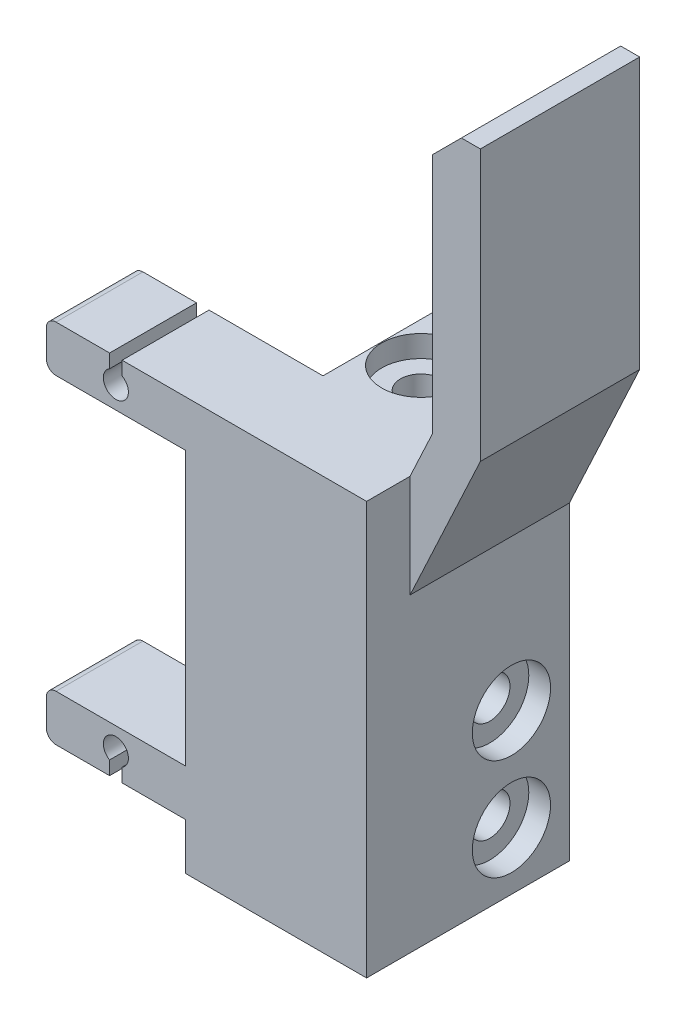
SolidWorks part; units mm, degrees
ref_plane "Front Plane" through (0, 0, 0) normal (0, 0, 1) x (1, 0, 0)
ref_plane "Top Plane" through (0, 0, 0) normal (0, 1, 0) x (1, 0, 0)
ref_plane "Right Plane" through (0, 0, 0) normal (1, 0, 0) x (0, 0, -1)
ref_plane "Plane1" through (0, 0, -10.16) normal (0, 0, -1) x (-1, 0, 0)
sketch "Sketch1" plane through (0, 0, -10.16) normal (0, 0, -1) x (-1, 0, 0)
  line L0 (20.137, 20.32) -> (-7.945, 20.32)
  line L1 (-7.945, 20.32) -> (-7.945, -15.875)
  line L2 (-7.945, -15.875) -> (20.137, -15.875)
  line L3 (20.137, -15.875) -> (20.137, 20.32)
  dimension "D1" = 20.137
  dimension "D2" = 7.945
  dimension "D3" = 20.32
  dimension "D4" = 15.875
extrude "Boss-Extrude1" add sketch "Sketch1" against normal blind 17.78
sketch "Sketch2" plane through (0, 0, -10.16) normal (0, 0, -1) x (-1, 0, 0)
  line L0 (-12.446, 48.26) -> (-14.1099, 48.26)
  line L1 (-14.1099, 48.26) -> (-14.1099, 24.5254)
  line L2 (-14.1099, 24.5254) -> (-7.945, 11.3048)
  line L3 (-7.945, 11.3048) -> (-7.945, 20.32)
  line L4 (-7.945, 20.32) -> (-9.906, 20.32)
  line L5 (-9.906, 20.32) -> (-9.906, 45.72)
  line L6 (-9.906, 45.72) -> (-12.446, 48.26)
  dimension "D1" = 7.945
  dimension "D2" = 9.906
  dimension "D3" = 12.446
  dimension "D4" = 14.1099
  dimension "D5" = 11.3048
  dimension "D6" = 20.32
  dimension "D7" = 24.5254
  dimension "D8" = 45.72
  dimension "D9" = 48.26
extrude "Boss-Extrude2" add sketch "Sketch2" against normal blind 13.97
sketch "Sketch3" plane through (0, 20.32, 0) normal (0, 1, 0) x (-1, 0, 0)
  line L0 (20.137, 0) -> (3.5, 0)
  line L1 (3.5, 0) -> (3.5, -10.16)
  line L2 (3.5, -10.16) -> (20.137, -10.16)
  line L3 (20.137, -10.16) -> (20.137, 0)
  line L4 (20.137, 7.62) -> (20.137, -10.16) construction
  line L5 (20.137, 7.62) -> (-7.945, 7.62) construction
  dimension "D1" = 16.637
  dimension "D2" = 7.62
  dimension "D3" = 17.78
extrude "Cut-Extrude1" cut sketch "Sketch3" against normal through all
sketch "Sketch4" plane through (0, 0, -10.16) normal (0, 0, -1) x (-1, 0, 0)
  line L0 (3.5, 15.875) -> (-3.5, 15.875)
  line L1 (-3.5, 15.875) -> (-3.5, -15.875)
  line L2 (-3.5, -15.875) -> (3.5, -15.875)
  line L3 (3.5, -15.875) -> (3.5, 15.875)
  line L4 (3.5, -15.875) -> (3.5, 20.32) construction
  line L5 (-12.446, 48.26) -> (-14.1099, 48.26) construction
  dimension "D1" = 7
  dimension "D2" = 32.385
  dimension "D3" = 64.135
extrude "Cut-Extrude2" cut sketch "Sketch4" against normal blind 10.16
sketch "Sketch5" plane through (0, 0, 7.62) normal (0, 0, 1) x (1, 0, 0)
  line L0 (-7.945, -15.875) -> (-7.945, -11.78)
  line L1 (-7.945, -11.78) -> (-20.137, -11.78)
  line L2 (-20.137, -11.78) -> (-20.137, -15.875)
  line L3 (-20.137, -15.875) -> (-7.945, -15.875)
  line L4 (-20.137, -15.875) -> (-20.137, 20.32) construction
  line L5 (7.945, -15.875) -> (-20.137, -15.875) construction
  dimension "D1" = 12.192
  dimension "D2" = 4.095
extrude "Cut-Extrude3" cut sketch "Sketch5" against normal through all
sketch "Sketch6" plane through (0, 0, 7.62) normal (0, 0, 1) x (1, 0, 0)
  line L0 (-13.491, -11.78) -> (-13.491, -10.5826)
  line L1 (-14.591, -10.5826) -> (-14.591, -11.78)
  line L2 (-14.591, -11.78) -> (-13.491, -11.78)
  line L3 (-7.945, -15.875) -> (-7.945, -11.78) construction
  line L4 (-7.945, -11.78) -> (-20.137, -11.78) construction
  arc A0 (-13.491, -10.5826) -> (-14.591, -10.5826) centre (-14.041, -9.63) cw
  dimension "D1" = 1.1
  dimension "D2" = 5.546
  dimension "D3" = 1.1974
extrude "Cut-Extrude4" cut sketch "Sketch6" against normal through all
sketch "Sketch7" plane through (0, 0, 7.62) normal (0, 0, 1) x (1, 0, 0)
  line L0 (-20.137, 16.256) -> (-20.137, -7.716)
  line L1 (-20.137, -7.716) -> (-7.945, -7.716)
  line L2 (-7.945, -7.716) -> (-7.945, 16.256)
  line L3 (-7.945, 16.256) -> (-20.137, 16.256)
  line L4 (-14.591, -10.5826) -> (-14.591, -11.78) construction
  line L5 (-7.945, -11.78) -> (-13.491, -11.78) construction
  dimension "D1" = 6.646
  dimension "D2" = 5.546
  dimension "D3" = 4.064
  dimension "D4" = 28.036
extrude "Cut-Extrude5" cut sketch "Sketch7" against normal through all
sketch "Sketch8" plane through (0, 0, 7.62) normal (0, 0, 1) x (1, 0, 0)
  line L0 (-14.591, 20.32) -> (-14.591, 19.1226)
  line L1 (-13.491, 19.1226) -> (-13.491, 20.32)
  line L2 (-13.491, 20.32) -> (-14.591, 20.32)
  line L3 (-20.137, -11.78) -> (-20.137, -7.716) construction
  line L4 (-14.591, -11.78) -> (-20.137, -11.78) construction
  arc A0 (-14.591, 19.1226) -> (-13.491, 19.1226) centre (-14.041, 18.17) cw
  dimension "D1" = 1.1
  dimension "D2" = 5.546
  dimension "D3" = 29.95
  dimension "D4" = 32.1
extrude "Cut-Extrude6" cut sketch "Sketch8" against normal through all
sketch "Sketch9" plane through (0, 0, 0) normal (0, 0, -1) x (-1, 0, 0)
  line L0 (7.945, -15.875) -> (3.5, -15.875)
  line L1 (3.5, -15.875) -> (3.5, 3.175)
  line L2 (3.5, 3.175) -> (7.945, 3.175)
  line L3 (7.945, 3.175) -> (7.945, -15.875)
  line L4 (-3.5, 15.875) -> (-3.5, -15.875) construction
  line L5 (7.945, -15.875) -> (-3.5, -15.875) construction
  dimension "D1" = 7
  dimension "D2" = 11.445
  dimension "D3" = 19.05
extrude "Boss-Extrude3" add sketch "Sketch9" along normal blind 10.16
ref_plane "Plane2" through (0, 18.17, 0) normal (0, -1, 0) x (1, 0, 0)
sketch "Sketch10" plane through (0, 18.17, 0) normal (0, -1, 0) x (1, 0, 0)
  line L0 (-12.941, 7.62) -> (-14.041, 7.62)
  line L1 (-14.041, 7.62) -> (-14.041, 0)
  line L2 (-14.041, 0) -> (-12.941, 0)
  line L3 (-12.941, 0) -> (-12.941, 7.62)
  line L4 (-14.041, 7.62) -> (-14.041, 0) construction
  dimension "D1" = 12.941
  dimension "D2" = 14.041
  dimension "D3" = 7.62
revolve "Cut-Revolve1" cut sketch "Sketch10" angle 360 about L4
ref_plane "Plane3" through (0, -9.63, 0) normal (0, 1, 0) x (1, 0, 0)
sketch "Sketch11" plane through (0, -9.63, 0) normal (0, 1, 0) x (1, 0, 0)
  line L0 (-12.941, 0) -> (-14.041, 0)
  line L1 (-14.041, 0) -> (-14.041, -7.62)
  line L2 (-14.041, -7.62) -> (-12.941, -7.62)
  line L3 (-12.941, -7.62) -> (-12.941, 0)
  line L4 (-14.041, 0) -> (-14.041, -7.62) construction
  dimension "D1" = 12.941
  dimension "D2" = 14.041
  dimension "D3" = 7.62
revolve "Cut-Revolve2" cut sketch "Sketch11" angle 360 about L4
hole_wizard "CBORE for M3 Hex Head Machine Screw1" positions "Sketch13" profile "Sketch12" counterbore size "M3" standard "ANSI Metric"
sketch "Sketch13" plane through (7.945, 0, 0) normal (1, 0, 0) x (0, 0, -1)
  line L0 (-7.62, 20.32) -> (-3.81, 20.32) construction
  point P0 (5.08, -1.905)
  point P1 (5.08, -10.795)
  dimension "D1" = 12.7
  dimension "D2" = 22.225
  dimension "D3" = 31.115
sketch "Sketch12" plane through (7.945, -1.905, -5.08) normal (0, 1, 0) x (0, 0, -1)
  line L0 (0, 0) -> (0, 4.445)
  line L1 (0, 4.445) -> (1.778, 4.445)
  line L3 (1.778, 4.445) -> (1.778, 1.905)
  line L4 (1.778, 1.905) -> (3.429, 1.905)
  line L5 (3.429, 1.905) -> (3.429, 0)
  line L7 (3.429, 0) -> (0, 0)
  line L11 (0, -6.35) -> (0, 107.95) construction
  dimension "Thru Hole Dia." = 3.556
  dimension "Thru Hole Depth" = 4.445
  dimension "C'Bore Dia." = 6.858
  dimension "C'Bore Depth" = 1.905
hole_wizard "CBORE for M3 Hex Head Machine Screw2" positions "Sketch15" profile "Sketch14" counterbore size "M3" standard "ANSI Metric"
sketch "Sketch15" plane through (0, 20.32, 0) normal (0, 1, 0) x (1, 0, 0)
  line L0 (-13.491, 0) -> (-13.491, -7.62) construction
  line L1 (-13.491, -7.62) -> (7.945, -7.62) construction
  point P0 (0, 5.08)
  dimension "D1" = 13.491
  dimension "D2" = 12.7
sketch "Sketch14" plane through (0, 20.32, -5.08) normal (1, 0, 0) x (0, 0, 1)
  line L0 (0, 0) -> (0, 36.195)
  line L1 (0, 36.195) -> (1.778, 36.195)
  line L3 (1.778, 36.195) -> (1.778, 1.905)
  line L4 (1.778, 1.905) -> (3.429, 1.905)
  line L5 (3.429, 1.905) -> (3.429, 0)
  line L7 (3.429, 0) -> (0, 0)
  line L11 (0, -6.35) -> (0, 107.95) construction
  dimension "Thru Hole Dia." = 3.556
  dimension "Thru Hole Depth" = 36.195
  dimension "C'Bore Dia." = 6.858
  dimension "C'Bore Depth" = 1.905
hole_wizard "CBORE for M3 Hex Head Machine Screw3" positions "Sketch17" profile "Sketch16" counterbore size "M3" standard "ANSI Metric"
sketch "Sketch17" plane through (-7.945, 0, 0) normal (-1, 0, 0) x (0, 0, 1)
  line L0 (7.62, -15.875) -> (7.62, -11.78) construction
  line L1 (-10.16, -15.875) -> (7.62, -15.875) construction
  point P0 (-5.08, -1.905)
  point P1 (-5.08, -10.795)
  dimension "D1" = 12.7
  dimension "D2" = 5.08
  dimension "D3" = 13.97
sketch "Sketch16" plane through (-7.945, -1.905, -5.08) normal (0, 1, 0) x (0, 0, 1)
  line L0 (0, 0) -> (0, 22.0549)
  line L1 (0, 22.0549) -> (1.778, 22.0549)
  line L3 (1.778, 22.0549) -> (1.778, 1.905)
  line L4 (1.778, 1.905) -> (3.429, 1.905)
  line L5 (3.429, 1.905) -> (3.429, 0)
  line L7 (3.429, 0) -> (0, 0)
  line L11 (0, -6.35) -> (0, 107.95) construction
  dimension "Thru Hole Dia." = 3.556
  dimension "Thru Hole Depth" = 22.0549
  dimension "C'Bore Dia." = 6.858
  dimension "C'Bore Depth" = 1.905
chamfer "Chamfer1" distance 4.2054 angle 25 1 edges at (9.906, 20.32, -3.175)
fillet "Fillet1" radius 0.85 4 edges at (-20.137, 20.32, 3.81) (-20.137, 16.256, 3.81) (-20.137, -11.78, 3.81) (-20.137, -7.716, 3.81)
